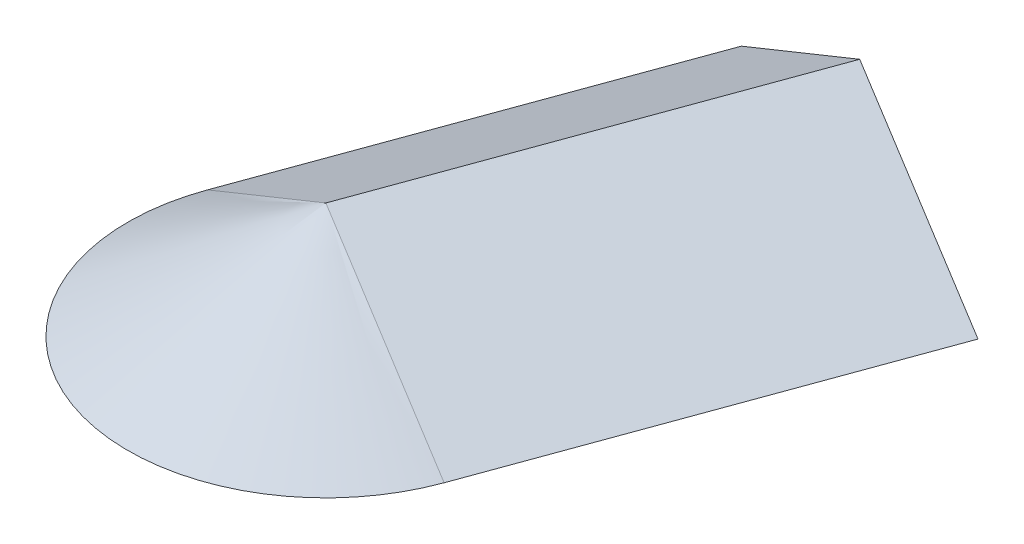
SolidWorks part; units mm, degrees
ref_plane "Ebene vorne" through (0, 0, 0) normal (0, 0, 1) x (1, 0, 0)
ref_plane "Ebene oben" through (0, 0, 0) normal (0, 1, 0) x (1, 0, 0)
ref_plane "Ebene rechts" through (0, 0, 0) normal (1, 0, 0) x (0, 0, -1)
sketch "Skizze3" plane through (0, 0, 0) normal (0, 1, 0) x (1, 0, 0)
  line L0 (0, 0) -> (25.2427, 69.3536)
  line L1 (0, 0) -> (0, 69.7418) construction
  dimension "D1" = 20
sketch "Skizze1" plane through (0, 0, 0) normal (0, 0, 1) x (1, 0, 0)
  line L0 (-26.3256, 0) -> (0, 0)
  line L1 (26.3256, 0) -> (0, 15.3566) construction
  line L2 (0, 15.3566) -> (-26.3256, 0)
  line L3 (0, 15.3566) -> (0, 0)
  line L4 (0, 0) -> (26.3256, 0) construction
  point P3 (0, 0)
  point P6 (2.0783, 30.1359)
revolve "Rotation1" add sketch "Skizze1" angle 360 about L3
ref_plane "Ebene2" through (0, 0, 0) normal (0.342, 0, -0.9397) x (-0.9397, 0, -0.342)
sketch "Skizze2" plane through (0, 0, 0) normal (0.342, 0, -0.9397) x (-0.9397, 0, -0.342)
  line L0 (0, 15.3566) -> (-26.3256, 0)
  line L1 (26.3256, 0) -> (0, 15.3566)
  line L2 (26.3256, 0) -> (0, 15.3566)
  line L3 (0, 15.3566) -> (-26.3256, 0)
  line L4 (-26.3256, 0) -> (26.3256, 0)
  line L5 (-26.3256, 0) -> (26.3256, 0)
  point P0 (223.5279, 214.0432)
extrude "Linear austragen1" add sketch "Skizze2" along normal blind 55.4
